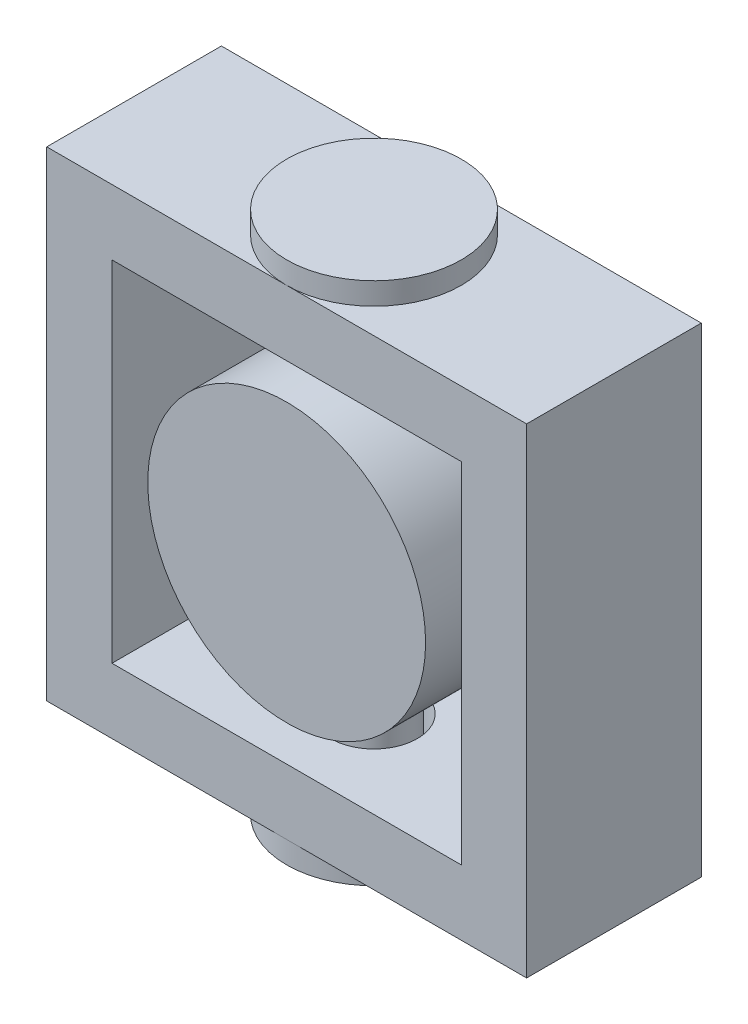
SolidWorks part; units mm, degrees
ref_plane "Front Plane" through (0, 0, 0) normal (0, 0, 1) x (1, 0, 0)
ref_plane "Top Plane" through (0, 0, 0) normal (0, 1, 0) x (1, 0, 0)
ref_plane "Right Plane" through (0, 0, 0) normal (1, 0, 0) x (0, 0, -1)
sketch "Sketch1" plane through (0, 0, 0) normal (0, 0, 1) x (1, 0, 0)
  line L1 (13.7372, -13.7372) -> (-13.7372, -13.7372)
  line L2 (13.7372, -13.7372) -> (13.7372, 13.7372)
  line L3 (13.7372, 13.7372) -> (-13.7372, 13.7372)
  line L4 (-13.7372, -13.7372) -> (-13.7372, 13.7372)
  line L5 (13.7372, -13.7372) -> (-13.7372, 13.7372) construction
  line L6 (13.7372, 13.7372) -> (-13.7372, -13.7372) construction
  line L7 (-10, 10) -> (10, 10)
  line L8 (-10, 10) -> (-10, -10)
  line L9 (-10, -10) -> (10, -10)
  line L10 (10, 10) -> (10, -10)
  line L11 (-10, 10) -> (10, -10) construction
  line L12 (-10, -10) -> (10, 10) construction
  point P0 (0, 0)
  point P6 (0, 0)
extrude "Boss-Extrude1" add sketch "Sketch1" along normal blind 10
sketch "Sketch3" plane through (0, 0, 10) normal (0, 0, 1) x (1, 0, 0)
  circle A0 centre (0, 0) radius 7.9531
extrude "Boss-Extrude2" add sketch "Sketch3" against normal blind 10 separate body
sketch "Sketch5" plane through (0, -13.7372, 0) normal (0, -1, 0) x (1, 0, 0)
  line L0 (-13.7372, 0) -> (13.7372, 0) construction
  line L1 (-13.7372, 10) -> (-13.7372, 0) construction
  circle A0 centre (0, 5) radius 2.4782
  point P2 (0, 0)
  point P5 (0, 0)
  point P8 (-13.7372, 5)
extrude "Cut-Extrude1" cut sketch "Sketch5" against normal blind 29
ref_plane "Plane1" through (0, -15, 0) normal (0, 1, 0) x (1, 0, 0)
sketch "Sketch6" plane through (0, -15, 0) normal (0, 1, 0) x (1, 0, 0)
  line L0 (-13.7372, -10) -> (-13.7372, 0) construction
  circle A0 centre (0, -5) radius 2
  circle A1 centre (0, -5) radius 2
  point P2 (0, 0)
  point P6 (-13.7372, -5)
  point P9 (0, 0)
extrude "Boss-Extrude3" add sketch "Sketch6" along normal blind 30 separate body contours A0
sketch "Sketch7" plane through (0, -15, 0) normal (0, 1, 0) x (1, 0, 0)
  circle A0 centre (0, -5) radius 5
  point P2 (0, 0)
extrude "Boss-Extrude4" add sketch "Sketch7" along normal blind 2
mirror "Mirror4" about plane through (0, 0, 0) normal (0, 1, 0) of "Boss-Extrude4"
